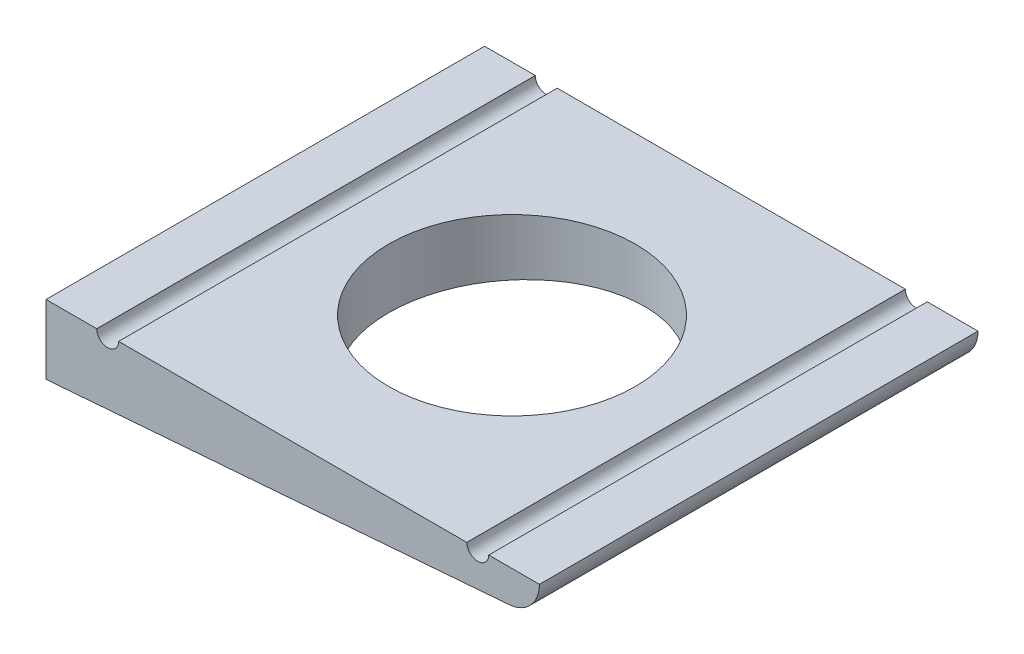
SolidWorks part; units mm, degrees
ref_plane "Plan de face" through (0, 0, 0) normal (0, 0, 1) x (1, 0, 0)
ref_plane "Plan de dessus" through (0, 0, 0) normal (0, 1, 0) x (1, 0, 0)
ref_plane "Plan de droite" through (0, 0, 0) normal (1, 0, 0) x (0, 0, -1)
mirrored part "Calle din 434_Rendre symétrique"
other "<Calle din 434>-<Enlèv. mat.-Extru.2>"
